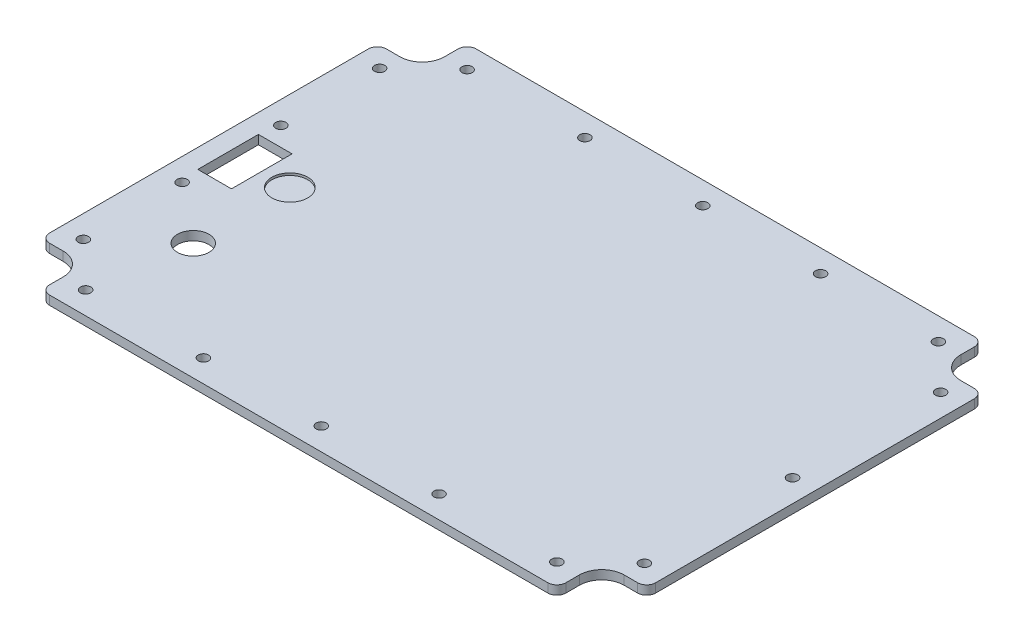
SolidWorks part; units mm, degrees
ref_plane "Plan de face" through (0, 0, 0) normal (0, 0, 1) x (1, 0, 0)
ref_plane "Plan de dessus" through (0, 0, 0) normal (0, 1, 0) x (1, 0, 0)
ref_plane "Plan de droite" through (0, 0, 0) normal (1, 0, 0) x (0, 0, -1)
sketch "Esquisse1" plane through (0, 0, 0) normal (0, 1, 0) x (1, 0, 0)
  line L0 (-69.1484, -43.0727) -> (80.8879, -43.0727) construction
  line L1 (-80.8879, 10.4273) -> (-59.6145, 10.4273) construction
  line L2 (-67.25, -36.0727) -> (-67.25, 34.9273)
  line L3 (67.75, -36.0727) -> (67.75, 34.9273)
  line L4 (-55.25, -48.0727) -> (55.75, -48.0727)
  line L5 (62.75, -48.0727) -> (62.75, 57.8384) construction
  line L6 (80.8879, 41.9273) -> (-77.3088, 41.9273) construction
  line L7 (-59.25, -7.8145) -> (-59.25, 0.8598) construction
  line L8 (82.6875, -0.5727) -> (-80.8879, -0.5727) construction
  line L9 (0.25, 56.1057) -> (0.25, -10.451) construction
  line L10 (62.75, 36.9273) -> (65.75, 36.9273)
  line L11 (57.75, 41.9273) -> (57.75, 44.9273)
  line L12 (-62.25, 36.9273) -> (-65.25, 36.9273)
  line L13 (-57.25, 41.9273) -> (-57.25, 44.9273)
  line L14 (57.75, -43.0727) -> (57.75, -46.0727)
  line L15 (62.75, -38.0727) -> (65.75, -38.0727)
  line L16 (-57.25, -43.0727) -> (-57.25, -46.0727)
  line L17 (-62.25, -38.0727) -> (-65.25, -38.0727)
  line L18 (-55.25, 46.9273) -> (55.75, 46.9273)
  line L19 (-26, 56.1057) -> (-26, 34.148) construction
  line L21 (-63, -7.3227) -> (-55.5, -7.3227)
  line L22 (-63, -7.3227) -> (-63, 6.1773)
  line L23 (-63, 6.1773) -> (-55.5, 6.1773)
  line L24 (-55.5, -7.3227) -> (-55.5, 6.1773)
  line L25 (-63, -7.3227) -> (-55.5, 6.1773) construction
  line L26 (-63, 6.1773) -> (-55.5, -7.3227) construction
  circle A0 centre (0.25, 41.9273) radius 1.15
  circle A1 centre (62.75, -0.5727) radius 1.15
  circle A2 centre (52.75, 41.9273) radius 1.15
  arc A3 (-57.25, 41.9273) -> (-62.25, 36.9273) centre (-62.25, 41.9273) cw
  arc A4 (57.75, 41.9273) -> (62.75, 36.9273) centre (62.75, 41.9273) ccw
  arc A5 (57.75, -43.0727) -> (62.75, -38.0727) centre (62.75, -43.0727) cw
  arc A6 (-57.25, -43.0727) -> (-62.25, -38.0727) centre (-62.25, -43.0727) ccw
  circle A7 centre (26.5, 41.9273) radius 1.15
  circle A8 centre (-52.25, -43.0727) radius 1.15
  circle A9 centre (-26, -43.0727) radius 1.15
  circle A10 centre (26.5, -43.0727) radius 1.15
  circle A11 centre (52.75, -43.0727) radius 1.15
  circle A12 centre (0.25, -43.0727) radius 1.15
  circle A13 centre (-62.25, 32.4273) radius 1.15
  circle A14 centre (-62.25, 10.4273) radius 1.15
  circle A15 centre (-62.25, -11.5727) radius 1.15
  circle A16 centre (-62.25, -33.5727) radius 1.15
  circle A17 centre (62.75, -33.5727) radius 1.15
  circle A20 centre (62.75, 32.4273) radius 1.15
  circle A21 centre (-26, 41.9273) radius 1.15
  circle A23 centre (-52.25, 41.9273) radius 1.15
  circle A24 centre (-49.25, -22.0927) radius 3.5
  arc A25 (-67.25, 34.9273) -> (-65.25, 36.9273) centre (-65.25, 34.9273) cw
  arc A26 (-57.25, 44.9273) -> (-55.25, 46.9273) centre (-55.25, 44.9273) cw
  arc A27 (55.75, 46.9273) -> (57.75, 44.9273) centre (55.75, 44.9273) cw
  arc A28 (65.75, 36.9273) -> (67.75, 34.9273) centre (65.75, 34.9273) cw
  arc A29 (67.75, -36.0727) -> (65.75, -38.0727) centre (65.75, -36.0727) cw
  arc A30 (57.75, -46.0727) -> (55.75, -48.0727) centre (55.75, -46.0727) cw
  arc A31 (-57.25, -46.0727) -> (-55.25, -48.0727) centre (-55.25, -46.0727) ccw
  arc A32 (-67.25, -36.0727) -> (-65.25, -38.0727) centre (-65.25, -36.0727) ccw
  point P79 (-59.25, -0.5727)
  point P86 (-67.25, 36.9273)
  point P89 (-57.25, 46.9273)
  point P92 (57.75, 46.9273)
  point P95 (67.75, 36.9273)
  point P98 (67.75, -38.0727)
  point P101 (57.75, -48.0727)
  point P104 (-57.25, -48.0727)
  point P107 (-67.25, -38.0727)
  dimension "D1" = 2
  dimension "D2" = 11
  dimension "D3" = 26.25
extrude "Boss.-Extru.1" add sketch "Esquisse1" along normal blind 2
sketch "Esquisse3" plane through (0, 2, 0) normal (0, 1, 0) x (1, 0, 0)
  circle A0 centre (-49.25, -0.5727) radius 4
extrude "Enlèv. mat.-Extru.1" cut sketch "Esquisse3" against normal blind 0.5
